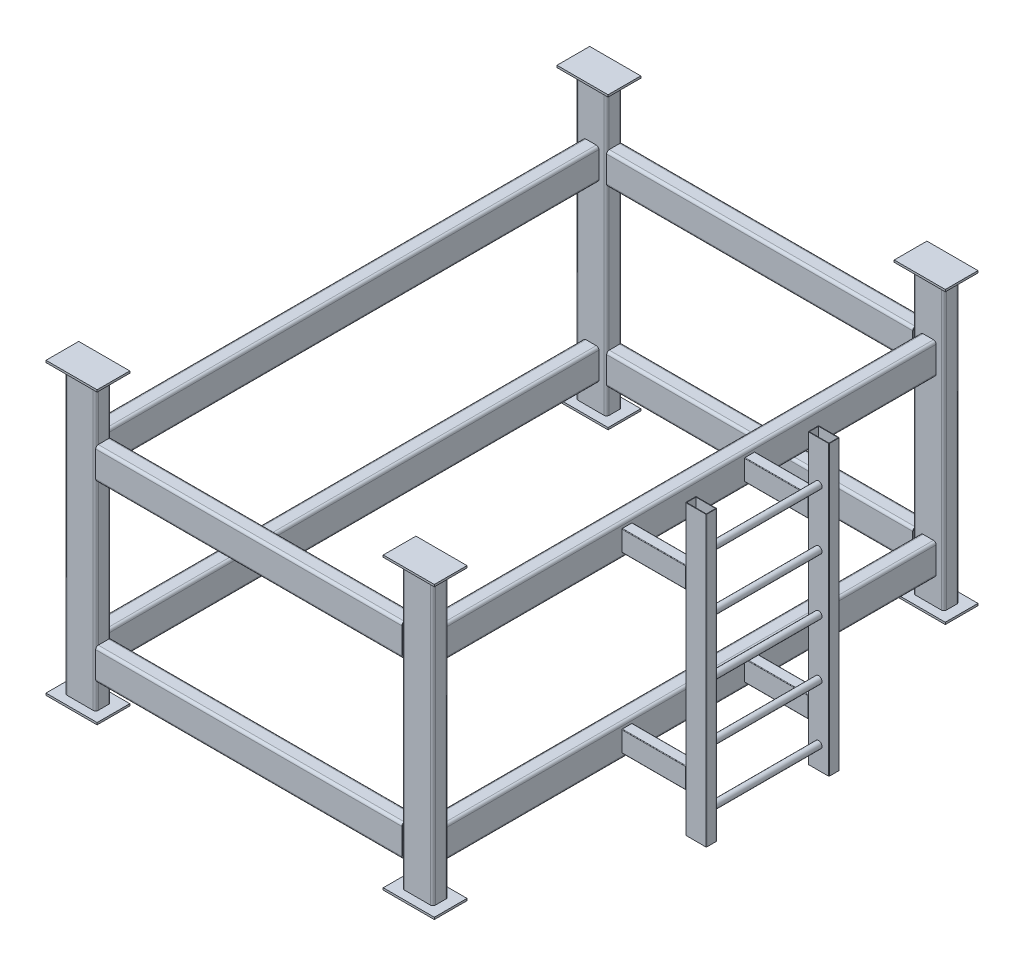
SolidWorks part; units mm, degrees
ref_plane "Front Plane" through (0, 0, 0) normal (0, 0, 1) x (1, 0, 0)
ref_plane "Top Plane" through (0, 0, 0) normal (0, 1, 0) x (1, 0, 0)
ref_plane "Right Plane" through (0, 0, 0) normal (1, 0, 0) x (0, 0, -1)
sketch "Sketch1" plane through (0, 0, 0) normal (0, 1, 0) x (1, 0, 0)
  line L1 (-825, 1250) -> (825, 1250)
  line L2 (-825, 1250) -> (-825, -1250)
  line L3 (-825, -1250) -> (825, -1250)
  line L4 (825, 1250) -> (825, -1250)
  line L5 (-825, 1250) -> (825, -1250) construction
  line L6 (-825, -1250) -> (825, 1250) construction
  point P0 (0, 0)
  dimension "D1" = 2500
  dimension "D2" = 1650
sketch3d "3DSketch1"
  line L0 (-825, 0, 1250) -> (-825, 1400, 1250)
  line L1 (-825, 0, -1250) -> (-825, 1400, -1250)
  line L2 (825, 0, -1250) -> (825, 1400, -1250)
  line L3 (825, 0, 1250) -> (825, 1400, 1250)
  line L5 (-825, 1050, -1250) -> (-825, 1050, 1250)
  line L6 (-825, 1050, -1250) -> (825, 1050, -1250)
  line L7 (825, 1050, -1250) -> (825, 1050, 1250)
  line L8 (-825, 1050, 1250) -> (825, 1050, 1250)
  line L9 (-825, 200, -1250) -> (-825, 200, 1250)
  line L10 (-825, 200, -1250) -> (825, 200, -1250)
  line L11 (825, 200, -1250) -> (825, 200, 1250)
  line L12 (-825, 200, 1250) -> (825, 200, 1250)
  dimension "D1" = 1400
  dimension "D2" = 350
  dimension "D3" = 850
other "Inch 6 X 3 X 0.25(1)"
ref_plane "Plane1" through (825, 0, 1250) normal (0, 1, 0) x (0, 0, -1)
sketch "Sketch11" plane through (825, 0, 1250) normal (0, 1, 0) x (0, 0, -1)
  line L0 (-31.75, 63.5) -> (-31.75, -63.5)
  line L1 (-25.4, 76.2) -> (25.4, 76.2)
  line L2 (-38.1, 63.5) -> (-38.1, -63.5)
  line L3 (-25.4, -76.2) -> (25.4, -76.2)
  line L4 (38.1, 63.5) -> (38.1, -63.5)
  line L5 (-38.1, 76.2) -> (38.1, -76.2) construction
  line L6 (-38.1, -76.2) -> (38.1, 76.2) construction
  line L7 (-25.4, -69.85) -> (25.4, -69.85)
  line L8 (31.75, 63.5) -> (31.75, -63.5)
  line L9 (-25.4, 69.85) -> (25.4, 69.85)
  arc A0 (25.4, 76.2) -> (38.1, 63.5) centre (25.4, 63.5) cw
  arc A1 (-38.1, -63.5) -> (-25.4, -76.2) centre (-25.4, -63.5) ccw
  arc A2 (-25.4, 76.2) -> (-38.1, 63.5) centre (-25.4, 63.5) ccw
  arc A3 (25.4, -76.2) -> (38.1, -63.5) centre (25.4, -63.5) ccw
  arc A4 (-31.75, -63.5) -> (-25.4, -69.85) centre (-25.4, -63.5) ccw
  arc A5 (25.4, -69.85) -> (31.75, -63.5) centre (25.4, -63.5) ccw
  arc A6 (25.4, 69.85) -> (31.75, 63.5) centre (25.4, 63.5) cw
  arc A7 (-25.4, 69.85) -> (-31.75, 63.5) centre (-25.4, 63.5) ccw
  point P0 (0, 0)
  point P30 (0, 0)
  dimension "D3" = 12.7
  dimension "D1" = 76.2
  dimension "D2" = 152.4
  dimension "D4" = 6.35
sketch "Sketch12" plane through (0, 1400, 0) normal (0, 1, 0) x (1, 0, 0)
  line L0 (901.2, -1288.1) -> (748.8, -1211.9) construction
  line L1 (700, -1170) -> (950, -1170)
  line L2 (700, -1170) -> (700, -1330)
  line L3 (700, -1330) -> (950, -1330)
  line L4 (950, -1170) -> (950, -1330)
  line L5 (700, -1170) -> (950, -1330) construction
  line L6 (700, -1330) -> (950, -1170) construction
  point P0 (825, -1250)
  dimension "D1" = 250
  dimension "D2" = 160
extrude "Boss-Extrude1" add sketch "Sketch12" along normal blind 10 separate body
ref_plane "Plane2" through (0, 700, 0) normal (0, 1, 0) x (1, 0, 0)
mirror "Mirror2" about plane through (0, 0, 0) normal (0, 0, 1)
mirror "Mirror3" about plane through (0, 0, 0) normal (1, 0, 0)
mirror "Mirror4" about plane through (0, 700, 0) normal (0, 1, 0)
sketch "Sketch13" plane through (863.1, 0, 0) normal (1, 0, 0) x (0, 0, -1)
  line L0 (-1211.9, 1050) -> (1211.9, 1050) construction
  line L1 (-1211.9, 986.5) -> (-1211.9, 1113.5) construction
  line L2 (1211.9, 1113.5) -> (1211.9, 986.5) construction
  line L3 (-1211.9, 200) -> (1211.9, 200) construction
  line L4 (-1211.9, 136.5) -> (-1211.9, 263.5) construction
  line L5 (1211.9, 263.5) -> (1211.9, 136.5) construction
  line L6 (0, 200) -> (0, 1050) construction
  line L8 (-300, 200) -> (300, 200)
  line L9 (-300, 200) -> (-300, 1050)
  line L10 (-300, 1050) -> (300, 1050)
  line L11 (300, 200) -> (300, 1050)
  line L12 (-300, 200) -> (300, 1050) construction
  line L13 (-300, 1050) -> (300, 200) construction
  point P14 (0, 625)
  dimension "D1" = 600
sketch3d "3DSketch2"
  line L0 (863.1, 1050, 300) -> (1225.4, 1050, 300)
  line L1 (863.1, 200, 300) -> (1225.4, 200, 300)
  line L2 (1225.4, 1367.42, 300) -> (1225.4, -42.58, 300)
  line L3 (863.1, 1050, -300) -> (1225.4, 1050, -300)
  line L4 (1225.4, 1367.42, -300) -> (1225.4, -42.58, -300)
  line L5 (863.1, 200, -300) -> (1225.4, 200, -300)
  dimension "D1" = 362.3
  dimension "D2" = 1410
  dimension "D3" = 317.42
other "Inch 4 X 2 X 0.1(1)"
ref_plane "Plane3" through (863.1, 1050, 300) normal (1, 0, 0) x (0, 0, -1)
sketch "Sketch14" plane through (863.1, 1050, 300) normal (1, 0, 0) x (0, 0, -1)
  line L0 (-22.86, 48.26) -> (-22.86, -48.26)
  line L1 (-22.86, 50.8) -> (22.86, 50.8)
  line L2 (-25.4, 48.26) -> (-25.4, -48.26)
  line L3 (-22.86, -50.8) -> (22.86, -50.8)
  line L4 (25.4, 48.26) -> (25.4, -48.26)
  line L5 (-25.4, 50.8) -> (25.4, -50.8) construction
  line L6 (-25.4, -50.8) -> (25.4, 50.8) construction
  line L7 (-22.86, -48.26) -> (22.86, -48.26)
  line L8 (22.86, 48.26) -> (22.86, -48.26)
  line L9 (-22.86, 48.26) -> (22.86, 48.26)
  line L10 (0, 0) -> (-25.4, 0) construction
  line L11 (0, 0) -> (25.4, 0) construction
  arc A0 (22.86, 50.8) -> (25.4, 48.26) centre (22.86, 48.26) cw
  arc A1 (-25.4, -48.26) -> (-22.86, -50.8) centre (-22.86, -48.26) ccw
  arc A2 (-22.86, 50.8) -> (-25.4, 48.26) centre (-22.86, 48.26) ccw
  arc A3 (22.86, -50.8) -> (25.4, -48.26) centre (22.86, -48.26) ccw
  arc A4 (-22.86, -48.26) -> (-22.86, -48.26) centre (-22.86, -48.26) ccw
  arc A5 (22.86, -48.26) -> (22.86, -48.26) centre (22.86, -48.26) ccw
  arc A6 (22.86, 48.26) -> (22.86, 48.26) centre (22.86, 48.26) cw
  arc A7 (-22.86, 48.26) -> (-22.86, 48.26) centre (-22.86, 48.26) ccw
  point P0 (0, 0)
  point P32 (0, 0)
  dimension "D3" = 2.54
  dimension "D1" = 101.6
  dimension "D2" = 50.8
  dimension "D4" = 2.54
sketch3d "3DSketch3"
  line L0 (1225.4, -42.58, -274.6) -> (1225.4, 1367.42, -274.6) construction
  line L1 (1273.66, -42.58, -274.6) -> (1177.14, -42.58, -274.6) construction
  line L2 (1273.66, 1367.42, -274.6) -> (1177.14, 1367.42, -274.6) construction
  line L3 (1225.4, 1167.42, -274.6) -> (1225.4, 1167.42, 274.6)
  dimension "D1" = 200
other "Pipe - configured 33.7 X 4.0(1)"
ref_plane "Plane4" through (1225.4, 1167.42, -274.6) normal (0, 0, 1) x (1, 0, 0)
sketch "Sketch16" plane through (1225.4, 1167.42, -274.6) normal (0, 0, 1) x (1, 0, 0)
  circle A0 centre (0, 0) radius 12.85
  circle A1 centre (0, 0) radius 16.85
  point P3 (0, 16.85)
  point P5 (-16.85, 0)
  point P6 (0, -16.85)
  point P7 (16.85, 0)
  point P8 (0, 0)
  dimension "In_dia" = 25.7
  dimension "Out_dia" = 33.7
pattern_linear "LPattern1" count 5 spacing 275 along (0, -1, 0)
